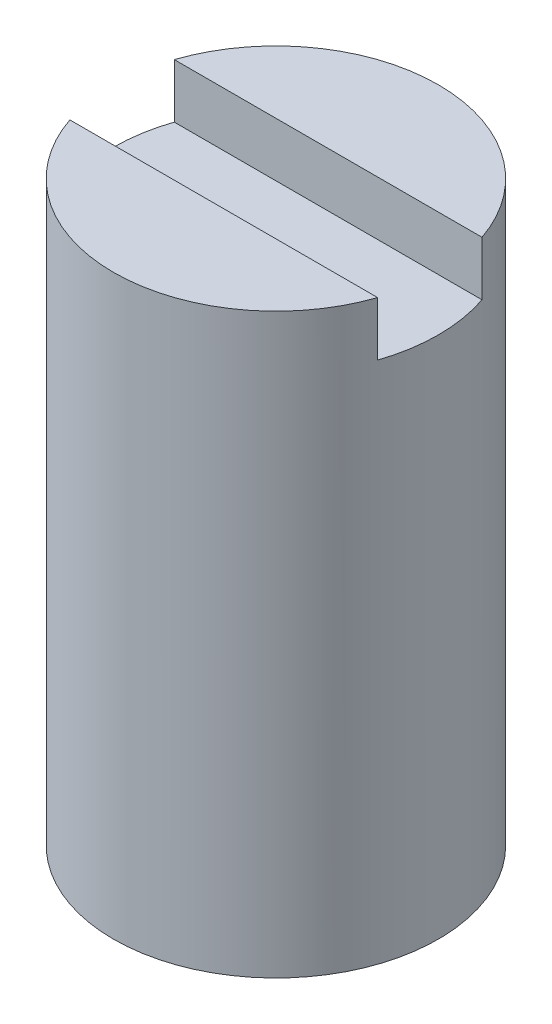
SolidWorks part; units mm, degrees
ref_plane "Front Plane" through (0, 0, 0) normal (0, 0, 1) x (1, 0, 0)
ref_plane "Top Plane" through (0, 0, 0) normal (0, 1, 0) x (1, 0, 0)
ref_plane "Right Plane" through (0, 0, 0) normal (1, 0, 0) x (0, 0, -1)
sketch "Sketch1" plane through (0, 0, 0) normal (0, 1, 0) x (1, 0, 0)
  circle A0 centre (0, 0) radius 9.525
  dimension "D1" = 0
  dimension "D2" = 19.05
extrude "Boss-Extrude1" add sketch "Sketch1" along normal blind 33.8549
sketch "Sketch2" plane through (0, 33.8549, 0) normal (0, 1, 0) x (1, 0, 0)
  line L5 (-12.7, -3.0607) -> (12.7, -3.0607)
  line L6 (-12.7, -3.0607) -> (-12.7, 3.0607)
  line L7 (-12.7, 3.0607) -> (12.7, 3.0607)
  line L8 (12.7, -3.0607) -> (12.7, 3.0607)
  line L9 (-12.7, -3.0607) -> (12.7, 3.0607) construction
  line L10 (-12.7, 3.0607) -> (12.7, -3.0607) construction
  point P0 (0, 0)
  dimension "D1" = 25.4
extrude "Cut-Extrude1" cut sketch "Sketch2" against normal blind 3.175
hole_wizard "1/4-20 Tapped Hole1" positions "Sketch4" profile "Sketch3" tap size "1/4-20" standard "ANSI Inch"
sketch "Sketch4" plane through (0, 0, 0) normal (0, -1, 0) x (-1, 0, 0)
  point P0 (0, 0)
  dimension "D1" = 0
sketch "Sketch3" plane through (0, 0, 0) normal (1, 0, 0) x (0, 0, -1)
  line L0 (0, 0) -> (0, 14.2338)
  line L1 (0, 14.2338) -> (2.5527, 12.7)
  line L2 (2.5527, 12.7) -> (2.5527, 0)
  line L5 (2.5527, 0) -> (0, 0)
  line L10 (0, 14.2338) -> (-2.5527, 12.7) construction
  line L11 (0, -6.35) -> (0, 107.95) construction
  dimension "Tap Drill Dia." = 5.1054
  dimension "Tap Drill Depth" = 12.7
  dimension "Drill Angle" = 118
